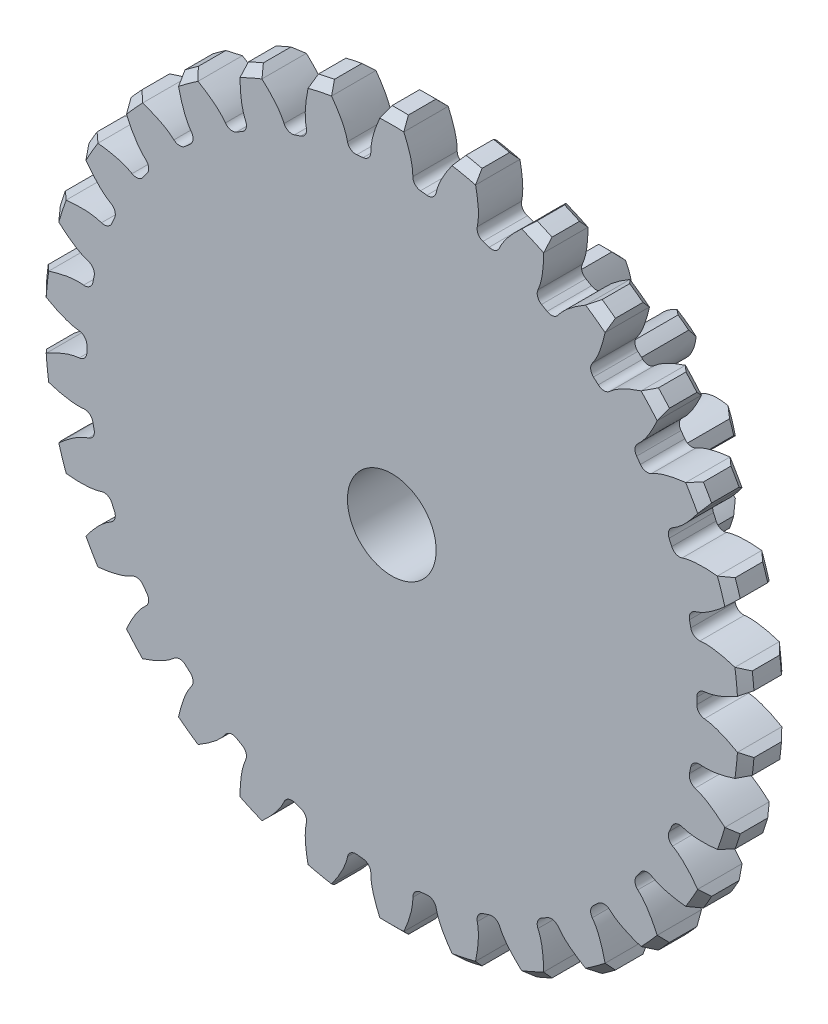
SolidWorks part; units mm, degrees
ref_plane "Plan1" through (0, 0, 0) normal (0, 0, 1) x (1, 0, 0)
ref_plane "Plan2" through (0, 0, 0) normal (0, 1, 0) x (1, 0, 0)
ref_plane "Plan3" through (0, 0, 0) normal (1, 0, 0) x (0, 0, -1)
sketch "Dent" plane through (0, 0, 0) normal (0, 0, 1) x (1, 0, 0)
  line L1 (-0.1488, 1.6323) -> (0, 1.2234)
  line L3 (0, 3) -> (0, -3) construction
  line L4 (0, 0) -> (0.1488, 2.9963) construction
  line L5 (0.3927, 2.469) -> (-0.3927, 2.469) construction
  line L6 (0.4036, 2.3143) -> (-0.4036, 2.3143) construction
  line L7 (-0.25, 0) -> (0.25, 0) construction
  line L9 (0.1488, 1.6323) -> (0, 1.2234)
  line L11 (0, 0) -> (0.3927, 2.469) construction
  line L12 (0, 0) -> (0.4036, 2.3143) construction
  circle A0 centre (0, 0) radius 2.5 construction
  circle A1 centre (0, 0) radius 3 construction
  arc A2 (0.1488, 2.9963) -> (-0.1488, 2.9963) centre (0, 0) ccw
  circle A3 centre (0, 0) radius 2.3492 construction
  point P2 (-0.3927, 2.469)
  point P3 (-0.4036, 2.3143)
  point P19 (0.3927, 2.469)
  point P20 (0.4036, 2.3143)
sketch "Esquisse2" plane through (0, 0, 0) normal (0, 0, 1) x (1, 0, 0)
  circle A0 centre (0, 0) radius 1.875
extrude "Base-Extrusion" add sketch "Esquisse2" against normal blind 4
extrude "Boss.-Extru.1" add sketch "Dent" against normal blind 4
fillet "Congé1" radius 0.19 4 edges at (0.2498, 1.8583, -2) (-0.2591, 1.857, -2)
chamfer "Chanfrein1" distance 0.19 angle 45 2 edges at (0, 3, -4)
pattern_circular "Répétition circulaire1" count 10 over 360 of "Congé1", "Boss.-Extru.1", "Chanfrein1"
sketch "Esquisse5" plane through (0, 0, 0) normal (0, 0, 1) x (1, 0, 0)
  line L0 (-3.3741, 5.9901) -> (-2.1938, 6.5156)
  arc A0 (-3.3741, 5.9901) -> (-3.2941, 6.2336) centre (-3.4674, 6.1556) ccw construction
  arc A1 (-2.4284, 6.6194) -> (-2.1938, 6.5156) centre (-2.2544, 6.6957) ccw construction
  arc A2 (-3.0845, 7.3815) -> (-3.4216, 7.2314) centre (0, 0) ccw construction
  arc A3 (-3.3741, 5.9901) -> (-3.2941, 6.2336) centre (-3.4674, 6.1556) ccw
  arc A4 (-2.4284, 6.6194) -> (-2.1938, 6.5156) centre (-2.2544, 6.6957) ccw
  arc A5 (-3.0845, 7.3815) -> (-3.4216, 7.2314) centre (0, 0) ccw
  spline S0 degree 3 poles (-3.4223, 7.0203) (-3.4213, 6.9079) (-3.4117, 6.6413) (-3.3566, 6.3725) (-3.2941, 6.2336) knots 0.104577 0.104577 0.104577 0.104577 0.271482 0.500037 0.500037 0.500037 0.500037 construction
  spline S1 degree 3 poles (-2.4284, 6.6194) (-2.4895, 6.7587) (-2.6527, 6.9793) (-2.8443, 7.1648) (-2.9272, 7.2407) knots 0.50013 0.50013 0.50013 0.50013 0.728518 0.895412 0.895412 0.895412 0.895412 construction
  spline S2 degree 3 poles (-3.0845, 7.3815) (-3.0318, 7.3349) (-2.9791, 7.2883) (-2.9272, 7.2407) knots 0 0 0 0 0.104588 0.104588 0.104588 0.104588 construction
  spline S3 degree 3 poles (-3.4223, 7.0203) (-3.4229, 7.0907) (-3.4222, 7.161) (-3.4216, 7.2314) knots 0.895423 0.895423 0.895423 0.895423 1 1 1 1 construction
  spline S4 degree 3 poles (-3.4223, 7.0203) (-3.4213, 6.9079) (-3.4117, 6.6413) (-3.3566, 6.3725) (-3.2941, 6.2336) knots 0.104577 0.104577 0.104577 0.104577 0.271482 0.500037 0.500037 0.500037 0.500037
  spline S5 degree 3 poles (-2.4284, 6.6194) (-2.4895, 6.7587) (-2.6527, 6.9793) (-2.8443, 7.1648) (-2.9272, 7.2407) knots 0.50013 0.50013 0.50013 0.50013 0.728518 0.895412 0.895412 0.895412 0.895412
  spline S6 degree 3 poles (-3.0845, 7.3815) (-3.0318, 7.3349) (-2.9791, 7.2883) (-2.9272, 7.2407) knots 0 0 0 0 0.104588 0.104588 0.104588 0.104588
  spline S7 degree 3 poles (-3.4223, 7.0203) (-3.4229, 7.0907) (-3.4222, 7.161) (-3.4216, 7.2314) knots 0.895423 0.895423 0.895423 0.895423 1 1 1 1
sketch "Esquisse6" plane through (0, 0, 0) normal (0, 0, 1) x (1, 0, 0)
  circle A0 centre (0, 0) radius 6.875
extrude "Extrusion1" add sketch "Esquisse6" along normal blind 1
extrude "Extrusion2" add sketch "Esquisse5" along normal blind 1
chamfer "Chanfrein2" distance 0.19 angle 45 2 edges at (-3.2539, 7.3084, 0) (-3.2539, 7.3084, 1)
pattern_circular "Répétition circulaire2" count 30 over 360 about axis through (0, 0, -4) along (0, 0, 1) of "Extrusion2", "Chanfrein2"
sketch "Esquisse7" plane through (0, 0, -4) normal (0, 0, -1) x (-1, 0, 0)
  circle A0 centre (0, 0) radius 1
  dimension "D1" = 2
extrude "Enlèv. mat.-Extru.1" cut sketch "Esquisse7" against normal through all
equation "\"Dp@Dent\" = \"Module@Dent\"*\"Nbr de dents@Répétition circulaire1\" "
equation "\"Dt@Dent\" = \"Module@Dent\"*(\"Nbr de dents@Répétition circulaire1\"+2)"
equation "\"Dpied@Esquisse2\" = \"Dp@Dent\"-(2.5*\"Module@Dent\")"
equation "\"Db@Dent\" = \"Dp@Dent\"*cos(\"Angle de pression@Dent\"*pi/180)"
equation "\"Ep au primitif@Dent\" =  (pi*\"Dp@Dent\"/2)/\"Nbr de dents@Répétition circulaire1\""
equation "\"D3@Dent\"=atn((Sin((sqr(((\"Dt@Dent\"/\"Db@Dent\")^2)-1))) -((sqr(((\"Dt@Dent\"/\"Db@Dent\")^2)-1)) * Cos((sqr(((\"Dt@Dent\"/\"Db@Dent\")^2)-1)))))/(Cos((sqr(((\"Dt@Dent\"/\"Db@Dent\")^2)-1))) +((sqr(((\"Dt@Dent\"/\"Db@"
equation "\"D4@Dent\"=atn((Sin((sqr(((\"Dp@Dent\"/\"Db@Dent\")^2)-1))) -((sqr(((\"Dp@Dent\"/\"Db@Dent\")^2)-1)) * Cos((sqr(((\"Dp@Dent\"/\"Db@Dent\")^2)-1)))))/(Cos((sqr(((\"Dp@Dent\"/\"Db@Dent\")^2)-1))) +((sqr(((\"Dp@Dent\"/\"Db@"
equation "\"D1@Congé1\" = \"Module@Dent\"*0.38"
equation "\"D1@Chanfrein1\" = \"Module@Dent\"*0.38"
